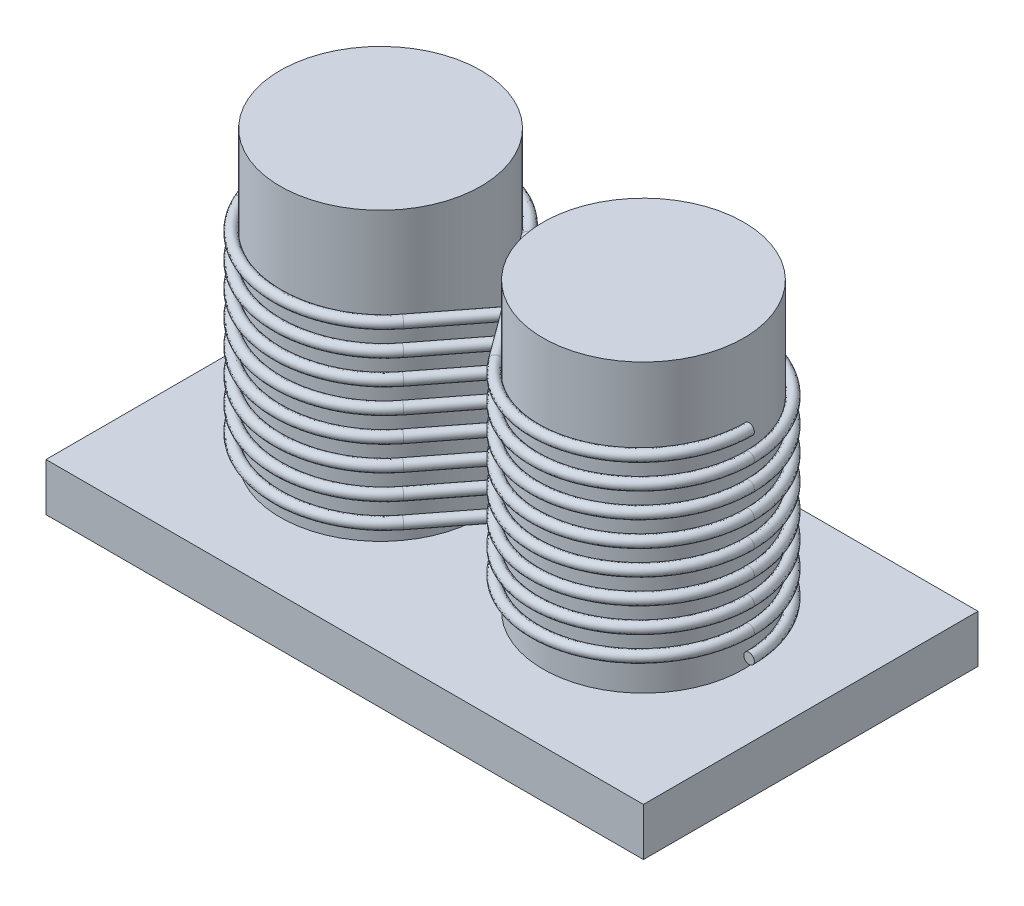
SolidWorks part; units mm, degrees
ref_plane "Ebene vorne" through (0, 0, 0) normal (0, 0, 1) x (1, 0, 0)
ref_plane "Ebene oben" through (0, 0, 0) normal (0, 1, 0) x (1, 0, 0)
ref_plane "Ebene rechts" through (0, 0, 0) normal (1, 0, 0) x (0, 0, -1)
sketch "Skizze9" plane through (0, 0, 0) normal (0, 1, 0) x (1, 0, 0)
  line L1 (-62.5, -35) -> (62.5, -35)
  line L2 (-62.5, -35) -> (-62.5, 35)
  line L3 (-62.5, 35) -> (62.5, 35)
  line L4 (62.5, -35) -> (62.5, 35)
  line L5 (-62.5, -35) -> (62.5, 35) construction
  line L6 (-62.5, 35) -> (62.5, -35) construction
  point P0 (0, 0)
  dimension "D1" = 70
  dimension "D2" = 125
extrude "Linear austragen3" add sketch "Skizze9" against normal blind 10
sketch "Skizze10" plane through (0, 0, 0) normal (0, 1, 0) x (1, 0, 0)
  circle A0 centre (27.5, 0) radius 21
  circle A1 centre (-27.5, 0) radius 21
  dimension "D1" = 42
  dimension "D2" = 42
  dimension "D3" = 27.5
  dimension "D4" = 27.5
extrude "Linear austragen4" add sketch "Skizze10" along normal blind 60
sketch "Skizze11" plane through (0, 0, 0) normal (0, 0, 1) x (1, 0, 0)
  line L0 (0, 0) -> (0, 14.7544)
  point P3 (0, 1.1)
  point P4 (0, 2.4)
  point P5 (0, 3.7)
  point P6 (0, 5)
  point P7 (0, 6.3)
  dimension "D1" = 1.1
  dimension "D2" = 1.3
  dimension "D3" = 2.6
  dimension "D4" = 1.3
  dimension "D5" = 2.6
ref_plane "Ebene5" through (0, 1.1, 0) normal (0, 1, 0) x (-1, 0, 0)
sketch "Skizze12" plane through (0, 1.1, 0) normal (0, 1, 0) x (-1, 0, 0)
  line L0 (-9.7396, 13.1522) -> (9.7396, -13.1522)
  line L1 (9.7396, 13.1522) -> (-9.7396, -13.1522)
  circle A0 centre (-27.5, 0) radius 22.1
  circle A1 centre (27.5, 0) radius 22.1
  point P9 (49.6, 0)
  point P12 (-49.6, 0)
  dimension "D1" = 44.2
  dimension "D2" = 44.2
sketch "Skizze13" plane through (0, 1.1, 0) normal (0, 1, 0) x (-1, 0, 0)
  line L0 (-9.7396, 13.1522) -> (9.7396, -13.1522) construction
  line L1 (9.7396, 13.1522) -> (-9.7396, -13.1522) construction
  line L2 (-9.7396, 13.1522) -> (9.7396, -13.1522) construction
  line L3 (9.7396, 13.1522) -> (-9.7396, -13.1522)
  circle A0 centre (-27.5, 0) radius 22.1 construction
  circle A1 centre (27.5, 0) radius 22.1 construction
  arc A2 (-9.7396, 13.1522) -> (-49.6, 0) centre (-27.5, 0) ccw construction
  arc A3 (9.7396, -13.1522) -> (49.6, 0) centre (27.5, 0) ccw construction
  arc A4 (49.6, 0) -> (9.7396, 13.1522) centre (27.5, 0) ccw
  arc A5 (-49.6, 0) -> (-9.7396, -13.1522) centre (-27.5, 0) ccw
surface "Oberfläche-Linear austragen1" sketch "Skizze13" parameters "D1"=20
sketch "Skizze15" plane through (0, 1.1, 0) normal (0, 1, 0) x (-1, 0, 0)
  line L0 (-9.7396, 13.1522) -> (9.7396, -13.1522) construction
  line L1 (-9.7396, 13.1522) -> (9.7396, -13.1522)
  arc A0 (9.7396, -13.1522) -> (49.6, 0) centre (27.5, 0) ccw construction
  arc A1 (-9.7396, 13.1522) -> (-49.6, 0) centre (-27.5, 0) ccw construction
  arc A2 (9.7396, -13.1522) -> (49.6, 0) centre (27.5, 0) ccw
  arc A3 (-9.7396, 13.1522) -> (-49.6, 0) centre (-27.5, 0) ccw
surface "Oberfläche-Linear austragen2" sketch "Skizze15"
sketch "Skizze14" plane through (0, 0, -35) normal (0, 0, 1) x (1, 0, 0)
  line L0 (49.6, 2.5) -> (-49.6, 5.1)
  line L1 (-49.6, 5.1) -> (49.6, 7.7) construction
  line L2 (49.6, 1.1) -> (49.6, 21.1) construction
  line L3 (49.6, 21.1) -> (49.6, 1.1) construction
  line L4 (-49.6, 21.1) -> (-49.6, 1.1) construction
  line L5 (49.6, 7.7) -> (-49.6, 10.3) construction
  line L6 (-62.5, 0) -> (62.5, 0) construction
  line L7 (-49.6, 5.1) -> (49.6, 5.1) construction
  line L8 (-49.6, 1.1) -> (-49.6, 21.1) construction
  line L9 (-49.6, 10.3) -> (49.6, 12.9) construction
  dimension "D1" = 2.5
  dimension "D2" = 5.2
sketch "Skizze16" plane through (0, 0, -35) normal (0, 0, -1) x (-1, 0, 0)
  line L0 (49.6, 5.1) -> (-49.6, 7.7) construction
  line L1 (49.6, 5.1) -> (-49.6, 7.7)
surface "Oberfläche-Linear austragen3" sketch "Skizze14"
surface "Oberfläche-Linear austragen4" sketch "Skizze16"
sketch "Skizze19" plane through (0, 0, -35) normal (0, 0, -1) x (-1, 0, 0)
  line L0 (-49.6, 7.7) -> (49.6, 10.3) construction
  line L1 (-49.6, 7.7) -> (49.6, 10.3)
surface "Oberfläche-Linear austragen5" sketch "Skizze19"
sketch "Skizze20" plane through (0, 0, -35) normal (0, 0, -1) x (-1, 0, 0)
  line L0 (49.6, 10.3) -> (-49.6, 12.9) construction
  line L1 (49.6, 10.3) -> (-49.6, 12.9)
surface "Oberfläche-Linear austragen6" sketch "Skizze20"
sketch3d "3D-Skizze2"
  line L0 (-9.7396, 4.0553, 13.1522) -> (9.7396, 3.5447, -13.1522)
  line L1 (-9.7396, 4.0553, 13.1522) -> (9.7396, 3.5447, -13.1522)
  line L2 (-9.7396, 6.1447, -13.1522) -> (9.7396, 6.6553, 13.1522)
  line L3 (-9.7396, 6.1447, -13.1522) -> (9.7396, 6.6553, 13.1522)
  line L4 (9.7396, 8.7447, -13.1522) -> (-9.7396, 9.2553, 13.1522)
  line L5 (9.7396, 8.7447, -13.1522) -> (-9.7396, 9.2553, 13.1522)
  line L6 (9.7396, 11.8553, 13.1522) -> (-9.7396, 11.3447, -13.1522)
  line L7 (9.7396, 11.8553, 13.1522) -> (-9.7396, 11.3447, -13.1522)
  spline S0 degree 3 poles (9.7396, 3.5447, -13.1522) (25.0959, 3.1422, -33.8889) (49.6, 2.5, -25.8036) (49.6, 2.5, 0) knots 0 0 0 0 1 1 1 1 weights 1 0.542227 0.542227 1
  spline S1 degree 3 poles (9.7396, 3.5447, -13.1522) (25.0959, 3.1422, -33.8889) (49.6, 2.5, -25.8036) (49.6, 2.5, 0) knots 0 0 0 0 1 1 1 1 weights 1 0.542227 0.542227 1
  spline S2 degree 3 poles (-49.6, 5.1, 0) (-49.6, 5.1, 25.8036) (-25.0959, 4.4578, 33.8889) (-9.7396, 4.0553, 13.1522) knots 0 0 0 0 1 1 1 1 weights 1 0.542227 0.542227 1
  spline S3 degree 3 poles (-49.6, 5.1, 0) (-49.6, 5.1, 25.8036) (-25.0959, 4.4578, 33.8889) (-9.7396, 4.0553, 13.1522) knots 0 0 0 0 1 1 1 1 weights 1 0.542227 0.542227 1
  spline S4 degree 3 poles (-49.6, 5.1, 0) (-49.6, 5.1, -25.8036) (-25.0959, 5.7422, -33.8889) (-9.7396, 6.1447, -13.1522) knots 0 0 0 0 1 1 1 1 weights 1 0.542227 0.542227 1
  spline S5 degree 3 poles (-49.6, 5.1, 0) (-49.6, 5.1, -25.8036) (-25.0959, 5.7422, -33.8889) (-9.7396, 6.1447, -13.1522) knots 0 0 0 0 1 1 1 1 weights 1 0.542227 0.542227 1
  spline S6 degree 3 poles (9.7396, 6.6553, 13.1522) (25.0959, 7.0578, 33.8889) (49.6, 7.7, 25.8036) (49.6, 7.7, 0) knots 0 0 0 0 1 1 1 1 weights 1 0.542227 0.542227 1
  spline S7 degree 3 poles (9.7396, 6.6553, 13.1522) (25.0959, 7.0578, 33.8889) (49.6, 7.7, 25.8036) (49.6, 7.7, 0) knots 0 0 0 0 1 1 1 1 weights 1 0.542227 0.542227 1
  spline S8 degree 3 poles (49.6, 7.7, 0) (49.6, 7.7, -25.8036) (25.0959, 8.3422, -33.8889) (9.7396, 8.7447, -13.1522) knots 0 0 0 0 1 1 1 1 weights 1 0.542227 0.542227 1
  spline S9 degree 3 poles (49.6, 7.7, 0) (49.6, 7.7, -25.8036) (25.0959, 8.3422, -33.8889) (9.7396, 8.7447, -13.1522) knots 0 0 0 0 1 1 1 1 weights 1 0.542227 0.542227 1
  spline S10 degree 3 poles (-49.6, 10.3, 0) (-49.6, 10.3, 25.8036) (-25.0959, 9.6578, 33.8889) (-9.7396, 9.2553, 13.1522) knots 0 0 0 0 1 1 1 1 weights 1 0.542227 0.542227 1
  spline S11 degree 3 poles (-49.6, 10.3, 0) (-49.6, 10.3, 25.8036) (-25.0959, 9.6578, 33.8889) (-9.7396, 9.2553, 13.1522) knots 0 0 0 0 1 1 1 1 weights 1 0.542227 0.542227 1
  spline S12 degree 3 poles (-9.7396, 11.3447, -13.1522) (-25.0959, 10.9422, -33.8889) (-49.6, 10.3, -25.8036) (-49.6, 10.3, 0) knots 0 0 0 0 1 1 1 1 weights 1 0.542227 0.542227 1
  spline S13 degree 3 poles (-9.7396, 11.3447, -13.1522) (-25.0959, 10.9422, -33.8889) (-49.6, 10.3, -25.8036) (-49.6, 10.3, 0) knots 0 0 0 0 1 1 1 1 weights 1 0.542227 0.542227 1
  spline S14 degree 3 poles (49.6, 12.9, 0) (49.6, 12.9, 25.8036) (25.0959, 12.2578, 33.8889) (9.7396, 11.8553, 13.1522) knots 0 0 0 0 1 1 1 1 weights 1 0.542227 0.542227 1
  spline S15 degree 3 poles (49.6, 12.9, 0) (49.6, 12.9, 25.8036) (25.0959, 12.2578, 33.8889) (9.7396, 11.8553, 13.1522) knots 0 0 0 0 1 1 1 1 weights 1 0.542227 0.542227 1
sketch "Skizze17" plane through (0, 0, 0) normal (0, 0, 1) x (1, 0, 0)
  circle A0 centre (49.6, 2.5) radius 1.1
  dimension "D1" = 2.2
sweep "Austragung8" add profiles "Skizze17" path "3D-Skizze2"
pattern_linear "Lineares Muster2" count 4 spacing 10.4 along (0, 1, 0)
